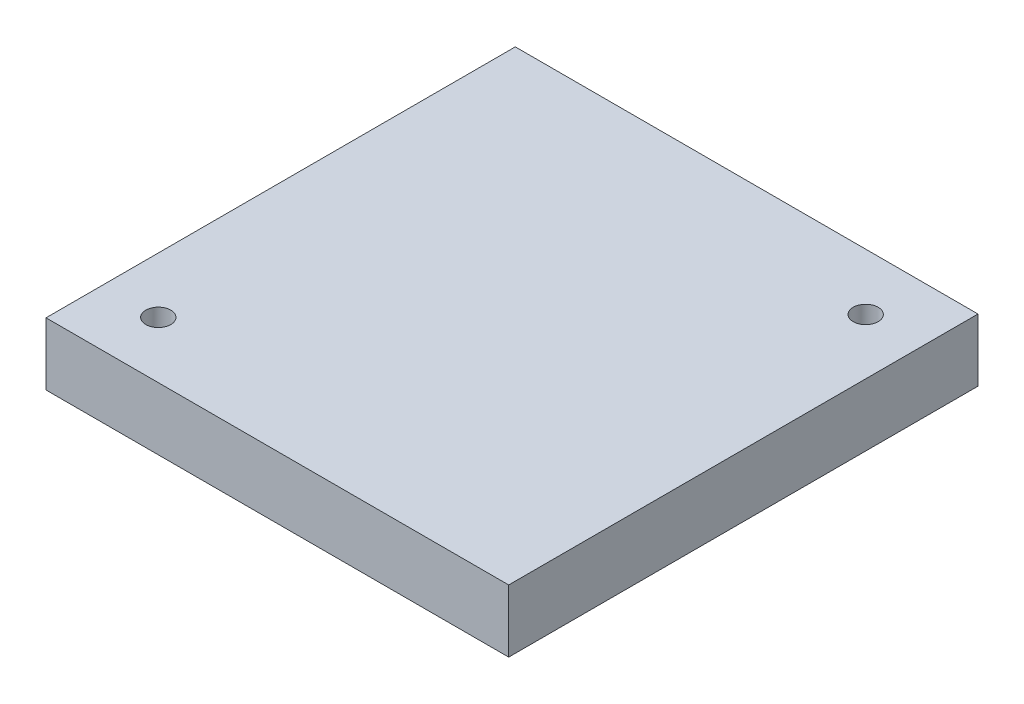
SolidWorks part; units mm, degrees
ref_plane "Front Plane" through (0, 0, 0) normal (0, 0, 1) x (1, 0, 0)
ref_plane "Top Plane" through (0, 0, 0) normal (0, 1, 0) x (1, 0, 0)
ref_plane "Right Plane" through (0, 0, 0) normal (1, 0, 0) x (0, 0, -1)
sketch "Sketch1" plane through (0, 0, 0) normal (0, 1, 0) x (1, 0, 0)
  line L1 (-18.5, -18.7639) -> (18.5, -18.7639)
  line L2 (-18.5, -18.7639) -> (-18.5, 18.7639)
  line L3 (-18.5, 18.7639) -> (18.5, 18.7639)
  line L4 (18.5, -18.7639) -> (18.5, 18.7639)
  line L5 (-18.5, -18.7639) -> (18.5, 18.7639) construction
  line L6 (-18.5, 18.7639) -> (18.5, -18.7639) construction
  point P0 (0, 0)
extrude "Boss-Extrude1" add sketch "Sketch1" along normal blind 14
sketch "Sketch2" plane through (-18.5, 0, 0) normal (-1, 0, 0) x (0, 0, 1)
  line L4 (-1.75, 10) -> (-1.75, 7) construction
  line L5 (-13.75, 10) -> (-1.75, 10) construction
  line L12 (-18.7639, 0) -> (18.7639, 0) construction
  line L14 (18.7639, 0) -> (18.7639, 55) construction
  line L15 (18.7639, 55) -> (-18.7639, 55) construction
  line L16 (-18.7639, 55) -> (-18.7639, 0) construction
  line L18 (-13.75, 10) -> (-13.75, 7) construction
  line L19 (-13.75, 7) -> (-1.75, 7) construction
  line L21 (1.75, 10) -> (13.75, 10) construction
  line L22 (1.75, 10) -> (1.75, 7) construction
  line L23 (1.75, 7) -> (13.75, 7) construction
  line L24 (13.75, 10) -> (13.75, 7) construction
  line L32 (-18.7639, 14) -> (18.7639, 14)
  line L33 (-18.7639, 14) -> (-18.7639, 5)
  line L34 (-18.7639, 5) -> (18.7639, 5)
  line L35 (18.7639, 14) -> (18.7639, 5)
  dimension "D2" = 2
extrude "Cut-Extrude1" cut sketch "Sketch2" against normal through all
shell "Shell1" thickness 2
sketch "Sketch4" plane through (0, 5, 0) normal (0, 1, 0) x (1, 0, 0)
  line L0 (-14.0416, -14.2419) -> (14.0416, 14.2419) construction
  line L5 (-18.5, -18.7639) -> (18.5, 18.7639) construction
  circle A2 centre (-14.0416, -14.2419) radius 1
  circle A3 centre (14.0416, 14.2419) radius 1
  point P7 (0, 0)
  dimension "D1" = 2
  dimension "D2" = 40
extrude "Cut-Extrude2" cut sketch "Sketch4" against normal blind 26
equation "\"thkness\"= 2mm"
equation "\"size\"= 65mm"
equation "\"side_len\"= \"size\" / (2 * sin ( 60 ) )"
equation "\"height\"= 50mm"
equation "\"D1@Sketch1\"=\"side_len\""
